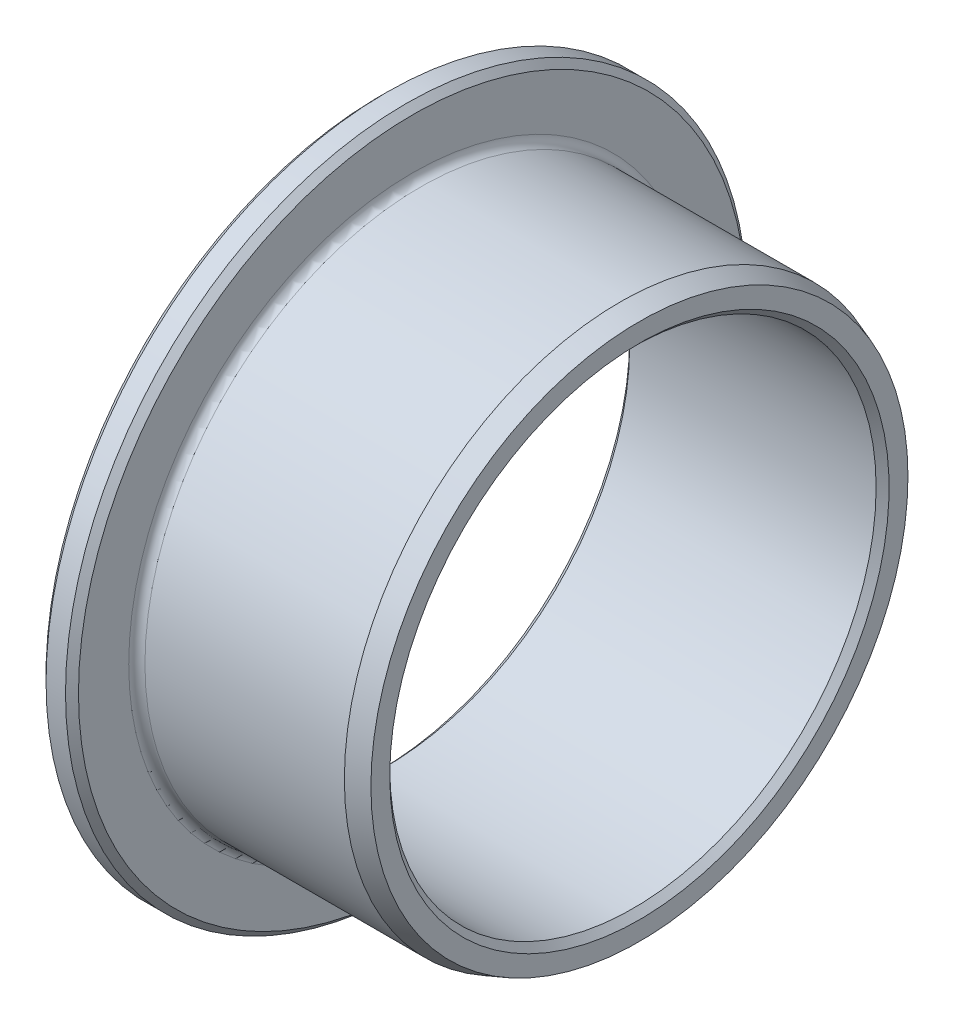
SolidWorks part; units mm, degrees
ref_plane "Face" through (0, 0, 0) normal (0, 0, 1) x (1, 0, 0)
ref_plane "Dessus" through (0, 0, 0) normal (0, 1, 0) x (1, 0, 0)
ref_plane "Droite" through (0, 0, 0) normal (1, 0, 0) x (0, 0, -1)
sketch "Esquisse1" plane through (0, 0, 0) normal (0, 0, 1) x (1, 0, 0)
  line L0 (-2, 15) -> (-2, 21)
  line L1 (-2, 21) -> (0, 21)
  line L2 (0, 21) -> (0, 17)
  line L3 (0, 17) -> (14, 17)
  line L4 (14, 17) -> (14, 15)
  line L5 (14, 15) -> (-2, 15)
  line L6 (-5.3127, 0) -> (18.9323, 0) construction
  dimension "D1" = 21
  dimension "D2" = 15
  dimension "D3" = 2
  dimension "D4" = 17
  dimension "D5" = 16
revolve "Base-Révolution" add sketch "Esquisse1" angle 360 about L6
fillet "Congé2" radius 0.5 1 edges at (0, 0, 17)
chamfer "Chanfrein1" distance 0.4 angle 45 4 edges at (0, 0, 21) (-2, 0, 21) (-2, 0, 15) (14, 0, 15)
chamfer "Chanfrein3" distance 1.2 angle 20 1 edges at (14, 0, 17)
